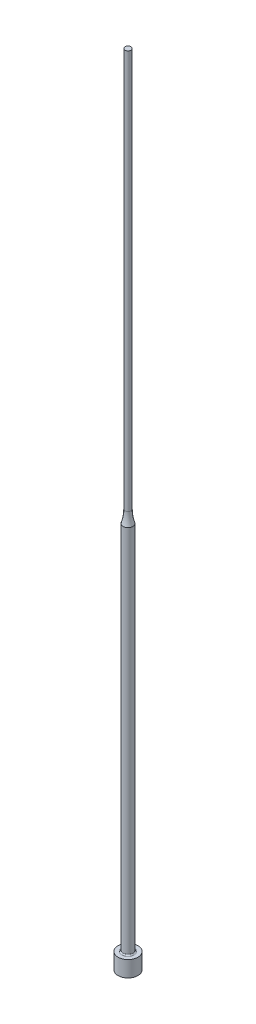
SolidWorks part; units mm, degrees
ref_plane "Front Plane" through (0, 0, 0) normal (0, 0, 1) x (1, 0, 0)
ref_plane "Top Plane" through (0, 0, 0) normal (0, 1, 0) x (1, 0, 0)
ref_plane "Right Plane" through (0, 0, 0) normal (1, 0, 0) x (0, 0, -1)
sketch "Sketch1" plane through (0, 0, 0) normal (0, 0, 1) x (1, 0, 0)
  line L0 (0, 0) -> (2.5, 0)
  line L1 (55, 0) -> (-55, 0) construction
  line L2 (2.5, 0) -> (2.5, 4)
  line L3 (2.5, 4) -> (1.55, 4)
  line L4 (1.25, 4.3) -> (1.25, 96.8775)
  line L6 (0.75, 100) -> (0.75, 200)
  line L7 (0.75, 200) -> (0, 200)
  line L8 (0, 200) -> (0, 0)
  arc A0 (0.75, 100) -> (1.25, 96.8775) centre (10.75, 100) ccw
  arc A1 (1.55, 4) -> (1.25, 4.3) centre (1.55, 4.3) cw
  dimension "D7" = 100
  dimension "D8" = 0.3
  dimension "D5" = 10
  dimension "D1" = 0.75
  dimension "D2" = 1.25
  dimension "D3" = 2.5
  dimension "D4" = 4
  dimension "D6" = 200
revolve "Revolve1" add sketch "Sketch1" angle 360 about L8
